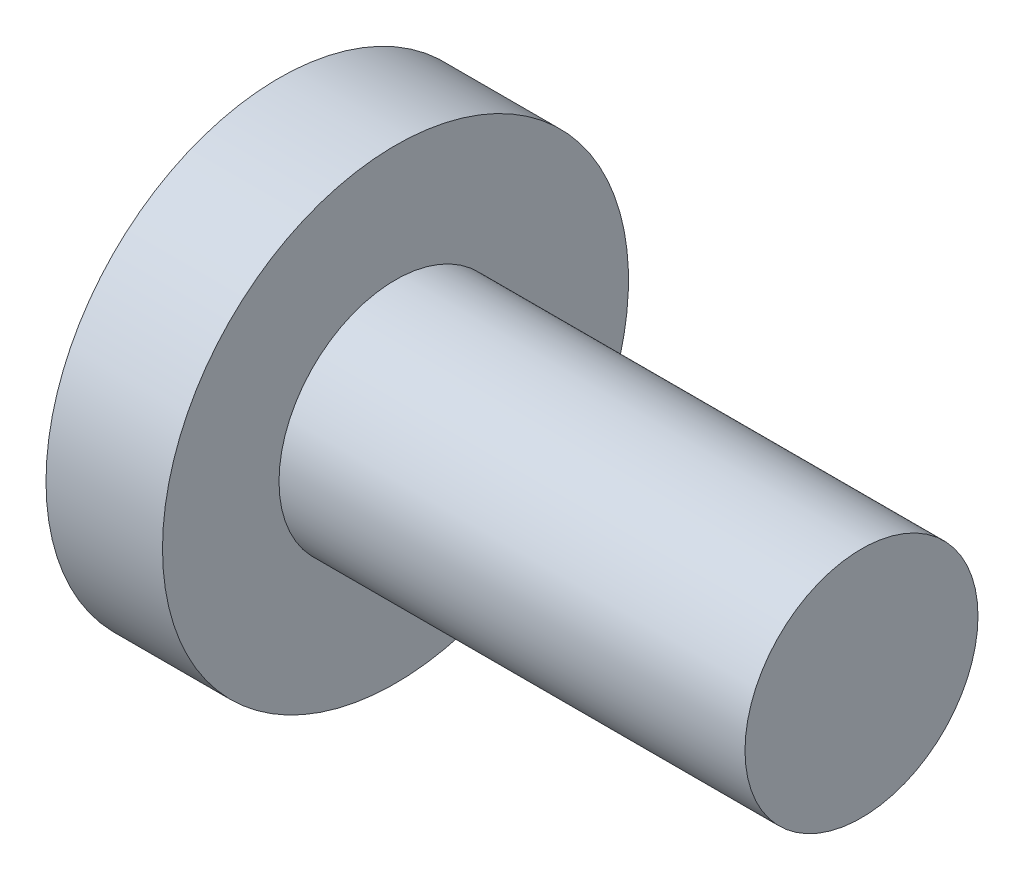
SolidWorks part; units mm, degrees
ref_plane "Ebene vorne" through (0, 0, 0) normal (0, 0, 1) x (1, 0, 0)
ref_plane "Ebene oben" through (0, 0, 0) normal (0, 1, 0) x (1, 0, 0)
ref_plane "Ebene rechts" through (0, 0, 0) normal (1, 0, 0) x (0, 0, -1)
sketch "Skizze1" plane through (0, 0, 0) normal (0, 0, 1) x (1, 0, 0)
  line L0 (0, 0) -> (61.8166, 0) construction
  line L1 (0, 0) -> (0, 10)
  line L2 (0, 10) -> (5, 10)
  line L3 (5, 10) -> (5, 5)
  line L4 (5, 5) -> (25, 5)
  line L5 (25, 5) -> (25, 0)
  line L6 (25, 0) -> (0, 0)
  dimension "D1" = 10
  dimension "D2" = 5
  dimension "D3" = 20
  dimension "D4" = 20
revolve "Rotation1" add sketch "Skizze1" angle 360 about L0
